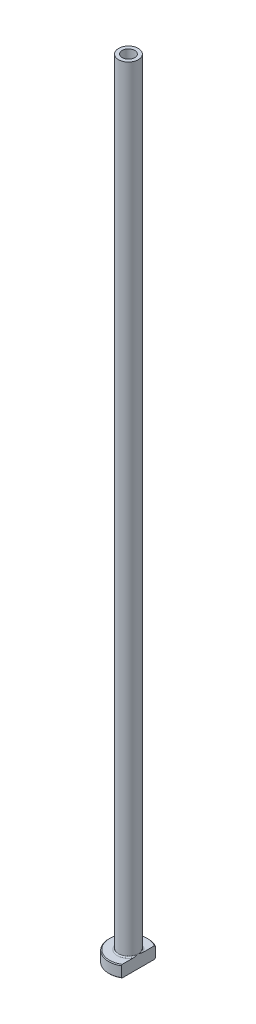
SolidWorks part; units mm, degrees
ref_plane "Front Plane" through (0, 0, 0) normal (0, 0, 1) x (1, 0, 0)
ref_plane "Top Plane" through (0, 0, 0) normal (0, 1, 0) x (1, 0, 0)
ref_plane "Right Plane" through (0, 0, 0) normal (1, 0, 0) x (0, 0, -1)
sketch "Sketch1" plane through (0, 0, 0) normal (0, 0, 1) x (1, 0, 0)
  line L0 (-1.6, 200) -> (-2.5, 200)
  line L1 (-2.5, 200) -> (-2.5, 3)
  line L2 (-2.5, 3) -> (-5, 3)
  line L3 (-5, 3) -> (-5, 0)
  line L4 (4.125, 0) -> (-4.125, 0) construction
  line L5 (-5, 0) -> (-1.85, 0)
  line L6 (-1.6, 155) -> (-1.6, 200)
  line L7 (0, 92.1877) -> (0, -15.5353) construction
  line L8 (0, -5.5) -> (0, 5.5) construction
  line L9 (-1.6, 155) -> (-1.85, 143)
  line L10 (-1.85, 143) -> (-1.85, 0)
  dimension "D1" = 0.25
  dimension "ID" = 3.2
  dimension "OD" = 5
  dimension "L" = 200
  dimension "H" = 10
  dimension "T" = 3
  dimension "N" = 45
  dimension "D2" = 12
  dimension "L-N" = 155
revolve "Revolve1" add sketch "Sketch1" angle 360 about L7
fillet "Fillet1" radius 0.3 1 edges at (0, 3, 2.5)
chamfer "Chamfer1" distance 0.2 angle 45 2 edges at (0, 3, 5) (0, 0, 5)
sketch "Sketch2" plane through (0, 0, 0) normal (0, -1, 0) x (1, 0, 0)
  line L0 (2.5, 4.3301) -> (2.5, -4.3301)
  circle A0 centre (0, 0) radius 5 construction
  arc A1 (2.5, 4.3301) -> (2.5, -4.3301) centre (0, 0) cw
  circle A2 centre (0, 0) radius 2.5 construction
extrude "Cut-Extrude1" cut sketch "Sketch2" against normal through all
chamfer "Chamfer2" distance 0.5 angle 45 1 edges at (0, 0, 1.85)
